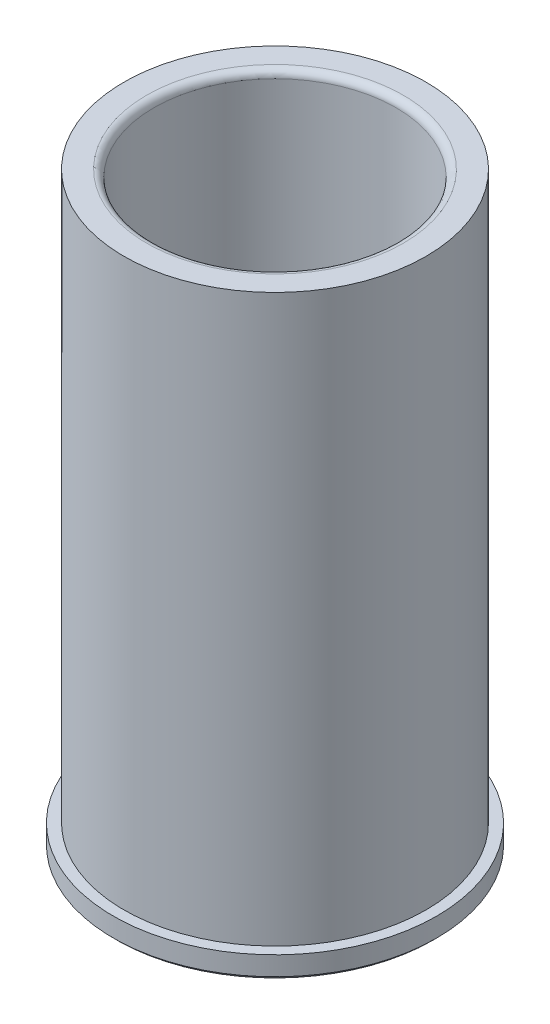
SolidWorks part; units mm, degrees
ref_plane "Front Plane" through (0, 0, 0) normal (0, 0, 1) x (1, 0, 0)
ref_plane "Top Plane" through (0, 0, 0) normal (0, 1, 0) x (1, 0, 0)
ref_plane "Right Plane" through (0, 0, 0) normal (1, 0, 0) x (0, 0, -1)
sketch "Sketch1" plane through (0, 0, 0) normal (0, 0, 1) x (1, 0, 0)
  line L0 (-33.2359, 0) -> (-33.9979, 0.762)
  line L1 (0, -1000) -> (0, 49000) construction
  line L2 (-25.4635, 123.825) -> (-25.4635, 0.762)
  line L3 (-26.2255, 0) -> (-33.2359, 0)
  line L4 (-33.9979, 0.762) -> (-33.9979, 4.7625)
  line L5 (-33.9979, 4.7625) -> (-31.7563, 4.7625)
  line L6 (-31.7564, 123.825) -> (-31.7563, 4.7625)
  line L7 (-31.7564, 123.825) -> (-25.4635, 123.825)
  line L8 (-26.2255, 0) -> (-25.4635, 0.762)
  dimension "OD" = 63.5127
  dimension "ID" = 50.927
  dimension "H" = 67.9958
  dimension "D2" = 45
  dimension "OVERALL LENGTH" = 123.825
  dimension "D4" = 0.762
  dimension "D5" = 135
  dimension "T" = 4.7625
revolve "Revolve1" add sketch "Sketch1" angle 360 about L1
fillet "Fillet1" radius 1.524 1 edges at (25.4635, 123.825, 0)
